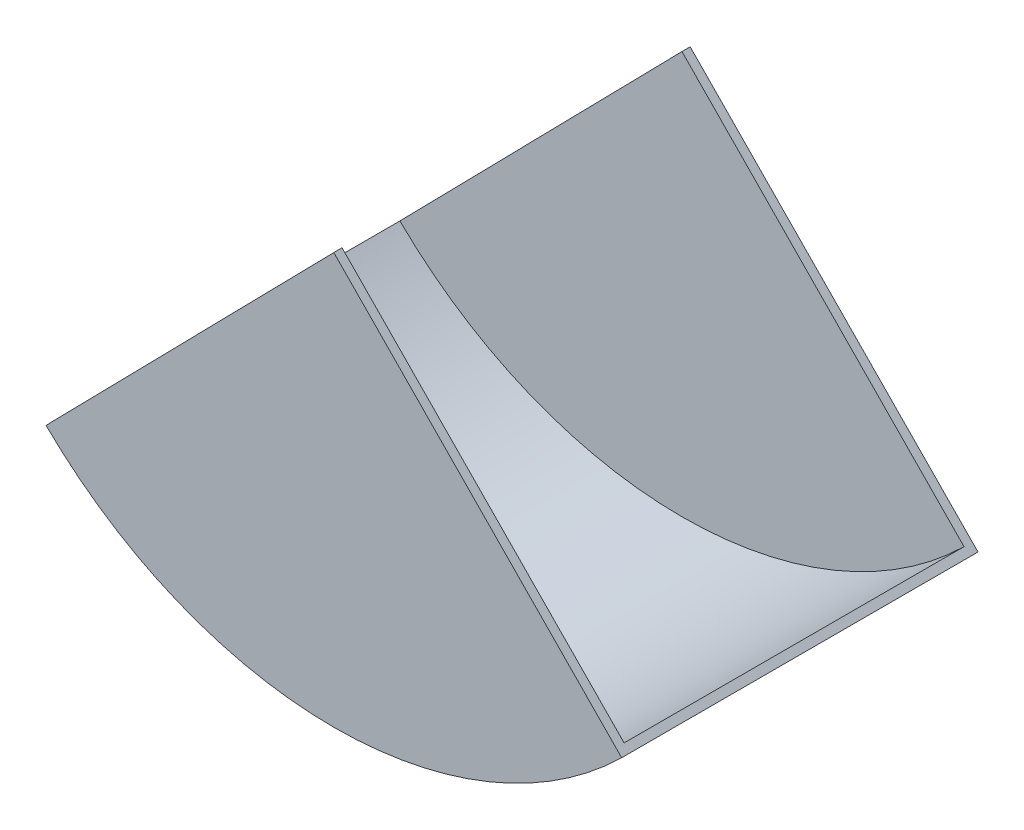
SolidWorks part; units mm, degrees
ref_plane "Plan de face" through (0, 0, 0) normal (0, 0, 1) x (1, 0, 0)
ref_plane "Plan de dessus" through (0, 0, 0) normal (0, 1, 0) x (1, 0, 0)
ref_plane "Plan de droite" through (0, 0, 0) normal (1, 0, 0) x (0, 0, -1)
sketch "Esquisse1" plane through (0, 0, 0) normal (0, 0, 1) x (1, 0, 0)
  line L0 (0, 0) -> (0, -150) construction
  line L1 (0, 0) -> (-105, -107.1214)
  line L2 (0, 0) -> (105, -107.1214)
  arc A0 (-105, -107.1214) -> (105, -107.1214) centre (0, 0) ccw
  dimension "D1" = 150
  dimension "D2" = 210
extrude "Extrusion1" add sketch "Esquisse1" along normal mid plane 130
sketch "Esquisse2" plane through (0, 0, 0) normal (0, 0, 1) x (1, 0, 0)
  line L0 (-102.9, -104.979) -> (0, 0)
  line L1 (0, 0) -> (102.9, -104.979)
  line L2 (0, 0) -> (-105, -107.1214) construction
  line L3 (105, -107.1214) -> (0, 0) construction
  arc A0 (-102.9, -104.979) -> (102.9, -104.979) centre (0, 0) ccw
  dimension "D1" = 147
extrude "Enlèv. mat.-Extru.1" cut sketch "Esquisse2" against normal mid plane 124
